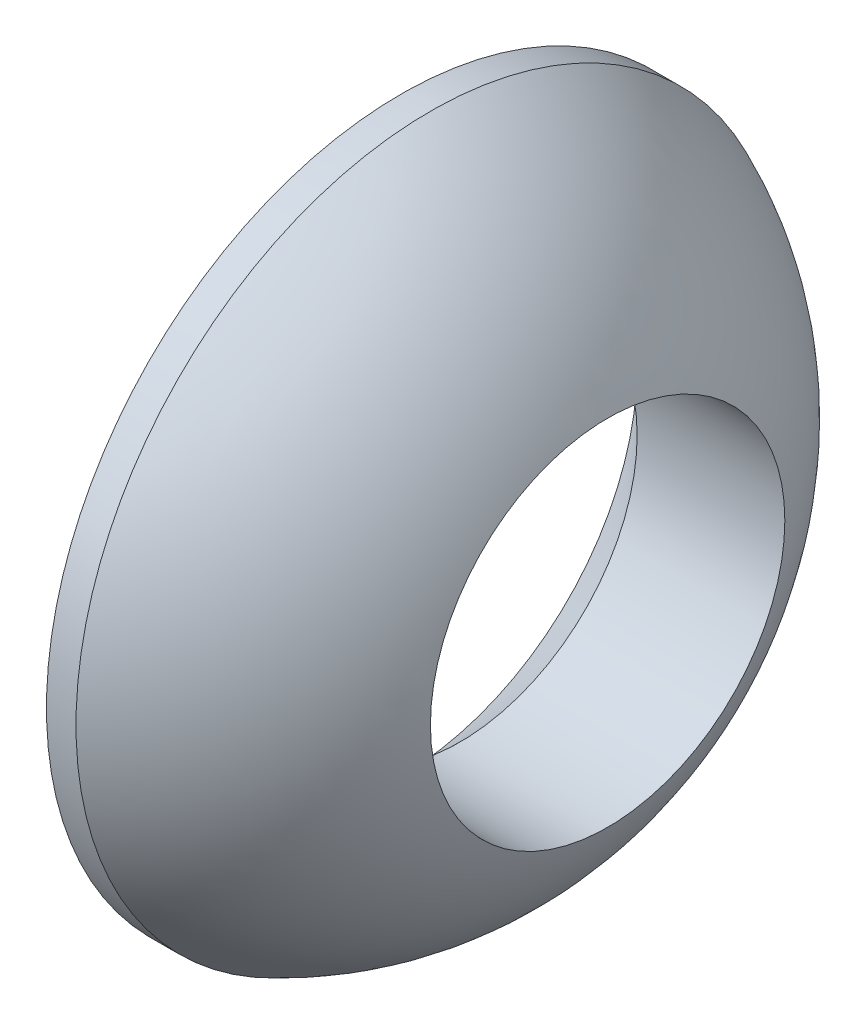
SolidWorks part; units mm, degrees
ref_plane "face" through (0, 0, 0) normal (0, 0, 1) x (1, 0, 0)
ref_plane "dessus" through (0, 0, 0) normal (0, 1, 0) x (1, 0, 0)
ref_plane "droite" through (0, 0, 0) normal (1, 0, 0) x (0, 0, -1)
sketch "Esquisse1" plane through (0, 0, 0) normal (0, 0, 1) x (1, 0, 0)
  line L0 (0, 0) -> (0, -6)
  line L1 (0, -6) -> (0.5, -6)
  line L2 (3.5, 0) -> (-20, 0) construction
  line L4 (3.5, -3) -> (3.5, 0)
  line L5 (3.5, 0) -> (0, 0)
  arc A0 (3.5, -3) -> (0.5, -6) centre (-1.6756, -0.8244) cw
  dimension "D1" = 6
  dimension "D5" = 5.6142
  dimension "D2" = 0.5
  dimension "D3" = 3
  dimension "D4" = 3.5
revolve "Base-Révolution" add sketch "Esquisse1" angle 360 about L2
sketch "Esquisse2" plane through (0, 0, 0) normal (1, 0, 0) x (0, 0, -1)
  circle A0 centre (0, 0) radius 3
  dimension "D1" = 6
extrude "Enlèv. mat.-Extru.3" cut sketch "Esquisse2" along normal blind 10
chamfer "Chanfrein1" distance 1 angle 45
